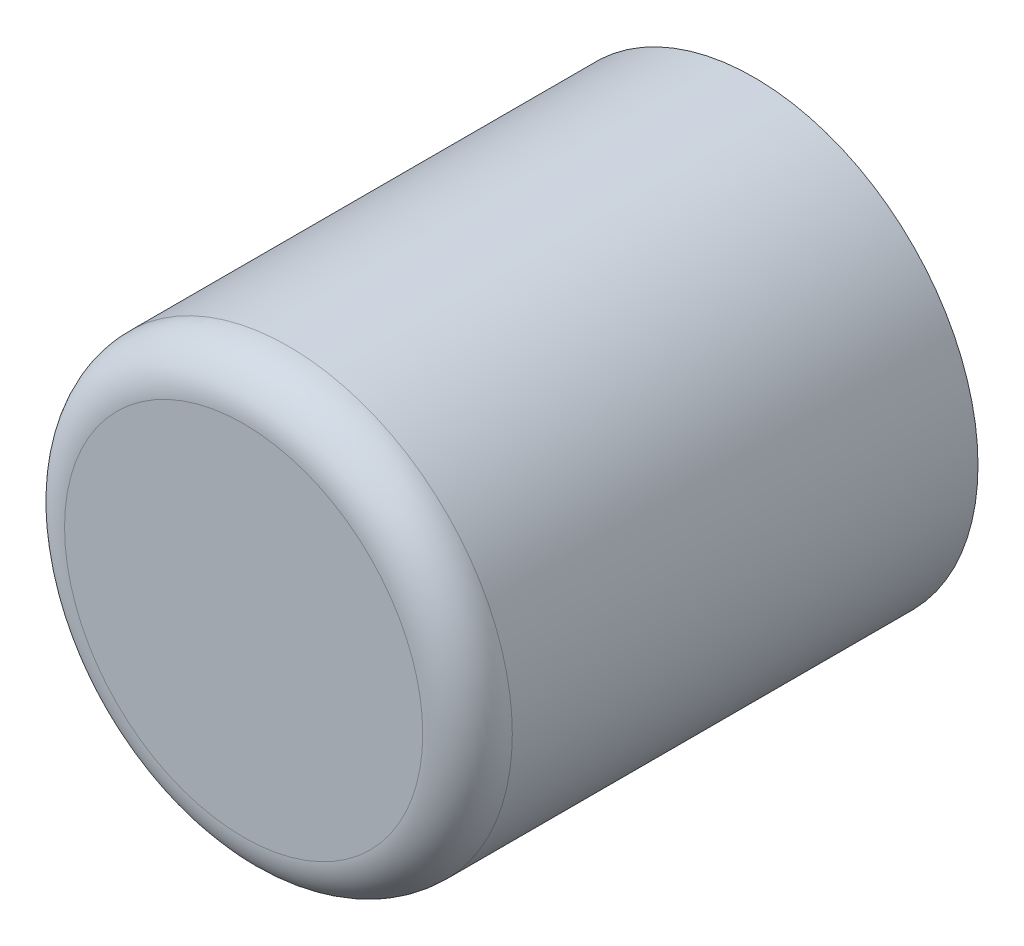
SolidWorks part; units mm, degrees
ref_plane "Front" through (0, 0, 0) normal (0, 0, 1) x (1, 0, 0)
ref_plane "Top" through (0, 0, 0) normal (0, 1, 0) x (1, 0, 0)
ref_plane "Right" through (0, 0, 0) normal (1, 0, 0) x (0, 0, -1)
sketch "Sketch1" plane through (0, 0, 0) normal (0, 0, 1) x (1, 0, 0)
  circle A0 centre (0, 0) radius 6.35
extrude "Base-Extrude" add sketch "Sketch1" along normal blind 14.478
fillet "Fillet1" radius 1.27
